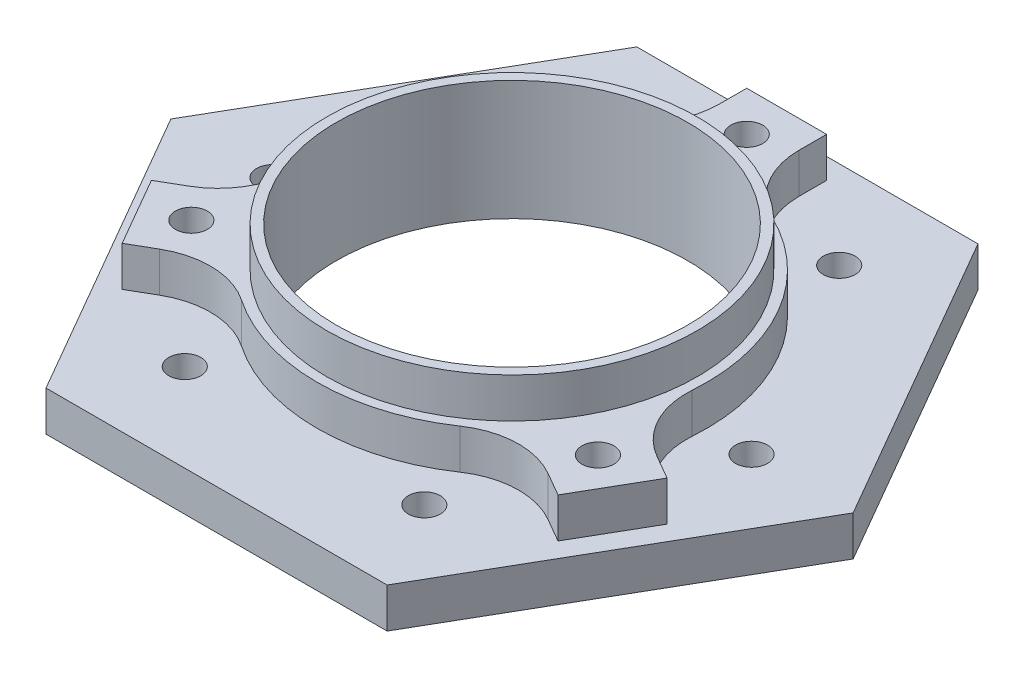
SolidWorks part; units mm, degrees
ref_plane "前视基准面" through (0, 0, 0) normal (0, 0, 1) x (1, 0, 0)
ref_plane "上视基准面" through (0, 0, 0) normal (0, 1, 0) x (1, 0, 0)
ref_plane "右视基准面" through (0, 0, 0) normal (1, 0, 0) x (0, 0, -1)
sketch "草图1" plane through (0, 0, 0) normal (0, 1, 0) x (1, 0, 0)
  line L0 (21.362, 37) -> (0, 0) construction
  line L1 (42.7239, 0) -> (21.362, 37)
  line L2 (21.362, 37) -> (-21.362, 37)
  line L3 (-21.362, 37) -> (-42.7239, 0)
  line L4 (-42.7239, 0) -> (-21.362, -37)
  line L5 (-21.362, -37) -> (21.362, -37)
  line L6 (21.362, -37) -> (42.7239, 0)
  circle A0 centre (0, 0) radius 22
  circle A1 centre (0, 0) radius 37 construction
  circle A2 centre (0, 0) radius 30 construction
  circle A3 centre (15, 25.9808) radius 2
  circle A4 centre (30, 0) radius 2
  circle A5 centre (15, -25.9808) radius 2
  circle A6 centre (-15, -25.9808) radius 2
  circle A7 centre (-30, 0) radius 2
  circle A8 centre (-15, 25.9808) radius 2
  point P26 (0, 0)
  dimension "D1" = 74
  dimension "D2" = 6
  dimension "D3" = 44
extrude "凸台-拉伸1" add sketch "草图1" along normal blind 5
sketch "草图3" plane through (0, 5, 0) normal (0, 1, 0) x (1, 0, 0)
  circle A0 centre (0, 0) radius 22
  circle A1 centre (0, 0) radius 24.4
extrude "凸台-拉伸2" add sketch "草图3" along normal blind 5
sketch "草图4" plane through (0, 10, 0) normal (0, 1, 0) x (1, 0, 0)
  circle A0 centre (0, 0) radius 22
  circle A1 centre (0, 0) radius 23.2
extrude "凸台-拉伸3" add sketch "草图4" along normal blind 5
sketch "草图5" plane through (0, 5, 0) normal (0, 1, 0) x (1, 0, 0)
  line L0 (0, 0) -> (0, 24.4) construction
  line L1 (32.2913, -12.8699) -> (23.1826, -7.611)
  line L2 (-5, 34.4) -> (5, 34.4)
  line L3 (5, 34.4) -> (5, 23.8822)
  line L4 (-5, 34.4) -> (-5, 23.8822)
  line L5 (0, 34.4) -> (0, 44.8409) construction
  line L6 (27.2913, -21.5301) -> (18.1826, -16.2712)
  line L7 (32.2913, -12.8699) -> (27.2913, -21.5301)
  line L8 (-27.2913, -21.5301) -> (-18.1826, -16.2712)
  line L9 (-32.2913, -12.8699) -> (-23.1826, -7.611)
  line L10 (-27.2913, -21.5301) -> (-32.2913, -12.8699)
  circle A1 centre (0, 29.4) radius 2
  circle A2 centre (0, 0) radius 24.4
  arc A3 (5, 23.8822) -> (-5, 23.8822) centre (0, 0) ccw
  circle A4 centre (25.4611, -14.7) radius 2
  arc A5 (18.1826, -16.2712) -> (23.1826, -7.611) centre (0, 0) ccw
  circle A6 centre (-25.4611, -14.7) radius 2
  arc A7 (-23.1826, -7.611) -> (-18.1826, -16.2712) centre (0, 0) ccw
  point P26 (0, 0)
  dimension "D2" = 5
  dimension "D3" = 3
  dimension "D1" = 0
extrude "凸台-拉伸4" add sketch "草图5" along normal up to surface (5 mm away)
fillet "圆角1" radius 10 6 edges at (-18.1826, 7.5, 16.2712) (18.1826, 7.5, 16.2712) (23.1826, 7.5, 7.611) (5, 7.5, -23.8822) (-23.1826, 7.5, 7.611) (-5, 7.5, -23.8822)
